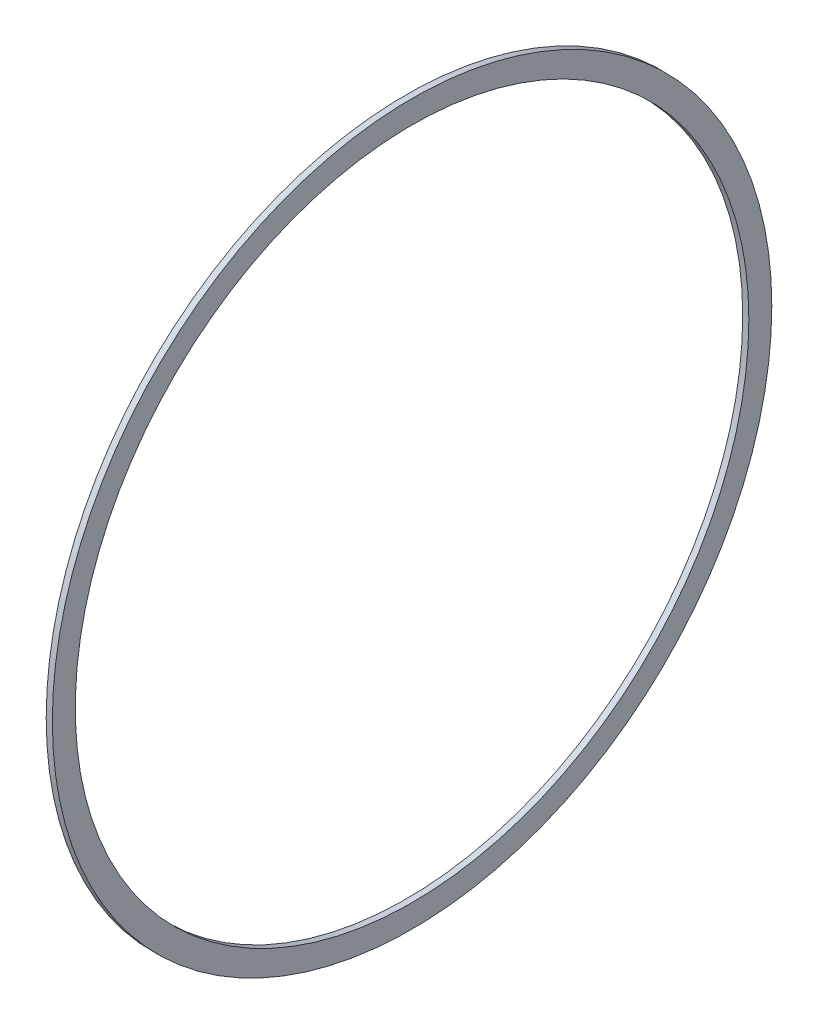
SolidWorks part; units mm, degrees
ref_plane "Спереди" through (0, 0, 0) normal (0, 0, 1) x (1, 0, 0)
ref_plane "Сверху" through (0, 0, 0) normal (0, 1, 0) x (1, 0, 0)
ref_plane "Справа" through (0, 0, 0) normal (1, 0, 0) x (0, 0, -1)
sketch "Эскиз1" plane through (0, 0, 0) normal (0, 0, 1) x (1, 0, 0)
  line L0 (0, 0) -> (0, 117.5)
  line L1 (0, 117.5) -> (2, 117.5)
  line L6 (2, 117.5) -> (2, 0)
  line L7 (0, 0) -> (47.2859, 0) construction
  line L8 (0, 0) -> (2, 0)
  dimension "D1" = 235
  dimension "D3" = 2
revolve "Повернуть1" add sketch "Эскиз1" angle 360 about L7
sketch "Эскиз2" plane through (2, 0, 0) normal (1, 0, 0) x (0, 0, -1)
  circle A0 centre (0, 0) radius 110
  dimension "D1" = 220
extrude "Вырез-Вытянуть1" cut sketch "Эскиз2" against normal through all
